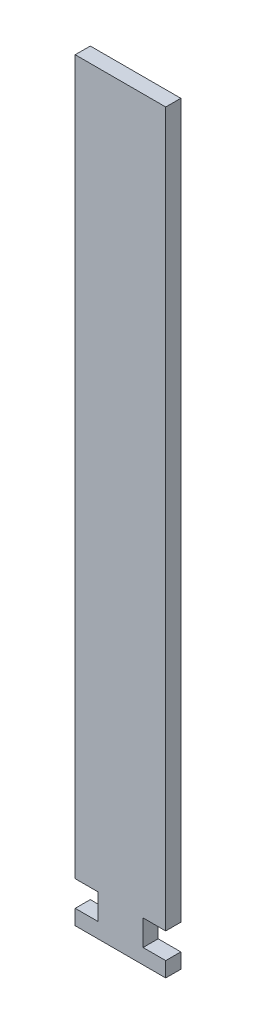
SolidWorks part; units mm, degrees
ref_plane "Ebene vorne" through (0, 0, 0) normal (0, 0, 1) x (1, 0, 0)
ref_plane "Ebene oben" through (0, 0, 0) normal (0, 1, 0) x (1, 0, 0)
ref_plane "Ebene rechts" through (0, 0, 0) normal (1, 0, 0) x (0, 0, -1)
sketch "Skizze1" plane through (0, 0, 0) normal (0, 0, 1) x (1, 0, 0)
  line L1 (-79.8415, -49.6988) -> (-19.8415, -49.6988)
  line L2 (-79.8415, -49.6988) -> (-79.8415, 450.3012)
  line L3 (-79.8415, 450.3012) -> (-19.8415, 450.3012)
  line L4 (-19.8415, -49.6988) -> (-19.8415, 450.3012)
  dimension "D1" = 500
  dimension "D2" = 60
extrude "Aufsatz-Linear austragen1" add sketch "Skizze1" along normal blind 10
sketch "Skizze2" plane through (0, 0, 10) normal (0, 0, 1) x (1, 0, 0)
  line L0 (-19.8415, -49.6988) -> (-19.8415, 450.3012) construction
  line L1 (-19.8415, -39.6988) -> (-34.8415, -39.6988)
  line L2 (-19.8415, -39.6988) -> (-19.8415, -22.6988)
  line L3 (-19.8415, -22.6988) -> (-34.8415, -22.6988)
  line L4 (-34.8415, -39.6988) -> (-34.8415, -22.6988)
  line L5 (-79.8415, 450.3012) -> (-79.8415, -49.6988) construction
  line L6 (-79.8415, -39.6988) -> (-64.8415, -39.6988)
  line L7 (-79.8415, -39.6988) -> (-79.8415, -22.6988)
  line L8 (-79.8415, -22.6988) -> (-64.8415, -22.6988)
  line L9 (-64.8415, -39.6988) -> (-64.8415, -22.6988)
  line L10 (-79.8415, -49.6988) -> (-19.8415, -49.6988) construction
  dimension "D1" = 17
  dimension "D2" = 17
  dimension "D3" = 15
  dimension "D4" = 15
  dimension "D5" = 10
  dimension "D6" = 10
extrude "Schnitt-Linear austragen1" cut sketch "Skizze2" against normal blind 10
